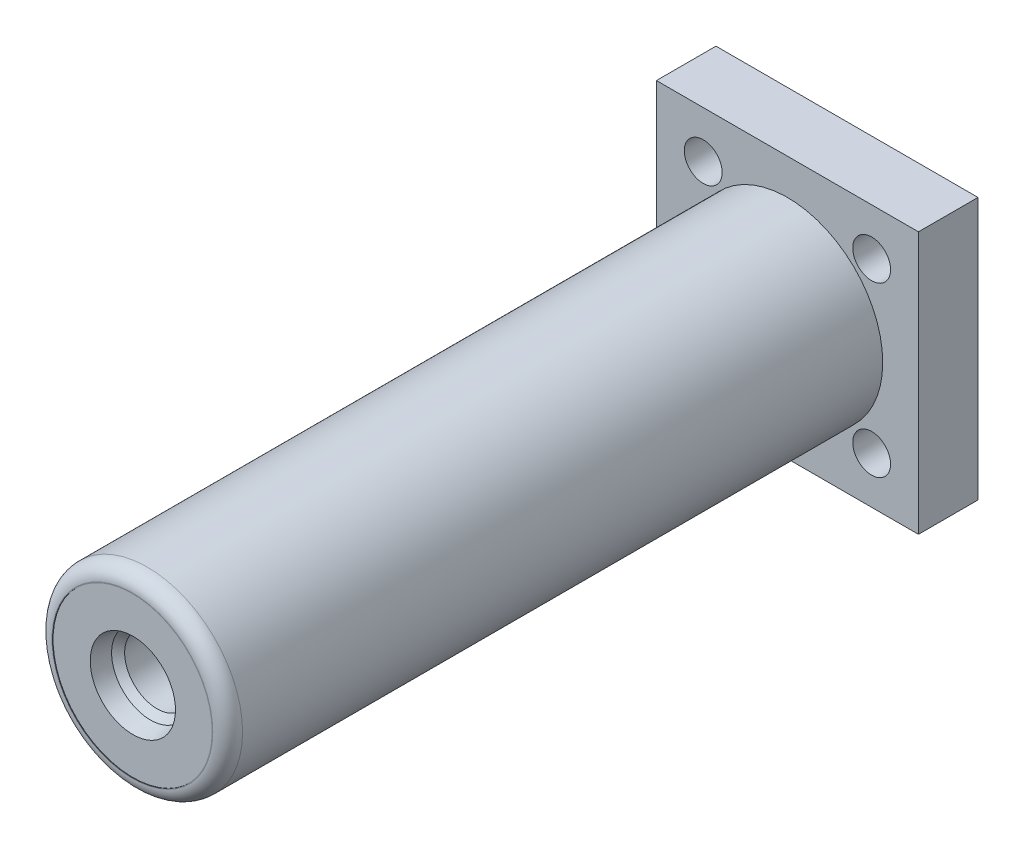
SolidWorks part; units mm, degrees
ref_plane "Front Plane" through (0, 0, 0) normal (0, 0, 1) x (1, 0, 0)
ref_plane "Top Plane" through (0, 0, 0) normal (0, 1, 0) x (1, 0, 0)
ref_plane "Right Plane" through (0, 0, 0) normal (1, 0, 0) x (0, 0, -1)
sketch "Sketch1" plane through (0, 0, 0) normal (0, 0, 1) x (1, 0, 0)
  line L0 (0, 0) -> (0, 13.97) construction
  line L1 (0, 0) -> (13.97, 0) construction
  line L2 (-13.97, 13.97) -> (13.97, 13.97)
  line L3 (13.97, 13.97) -> (13.97, -13.97)
  line L4 (-13.97, 13.97) -> (-13.97, -13.97)
  line L5 (-13.97, -13.97) -> (13.97, -13.97)
  point P9 (-13.97, 0)
  dimension "D1" = 13.97
  dimension "D2" = 13.97
extrude "base" add sketch "Sketch1" along normal blind 6.35
sketch "Sketch2" plane through (0, 0, 6.35) normal (0, 0, 1) x (1, 0, 0)
  circle A0 centre (0, 0) radius 10.16
  dimension "D1" = 20.32
extrude "cylinder" add sketch "Sketch2" along normal blind 69.85
sketch "Sketch3" plane through (0, 0, 0) normal (0, 0, -1) x (-1, 0, 0)
  circle A0 centre (0, 0) radius 5.715
  dimension "D1" = 11.43
extrude "bore" cut sketch "Sketch3" against normal blind 60.96
sketch "Sketch4" plane through (0, 0, 0) normal (0, 0, -1) x (-1, 0, 0)
  circle A0 centre (0, 0) radius 7.1374
  dimension "D1" = 14.2748
extrude "oring_bore" cut sketch "Sketch4" against normal blind 8.128
sketch "Sketch5" plane through (0, 0, 6.35) normal (0, 0, 1) x (1, 0, 0)
  line L0 (0, 0) -> (13.97, 0) construction
  line L1 (13.97, -13.97) -> (13.97, 13.97) construction
  line L2 (0, 0) -> (8.9803, 8.9803) construction
  circle A0 centre (0, 0) radius 12.7 construction
  circle A1 centre (8.9803, 8.9803) radius 2.0193
  circle A2 centre (8.9803, -8.9803) radius 2.0193
  circle A3 centre (-8.9803, -8.9803) radius 2.0193
  circle A4 centre (-8.9803, 8.9803) radius 2.0193
  dimension "D2" = 25.4
  dimension "D3" = 4.0386
  dimension "D1" = 45
extrude "bolt_circle" cut sketch "Sketch5" against normal through all
sketch "Sketch6" plane through (-13.97, 0, 0) normal (-1, 0, 0) x (0, 0, 1)
  circle A0 centre (67.31, 0) radius 2.3813
  dimension "D1" = 4.7625
  dimension "D2" = 67.31
extrude "side_port" cut sketch "Sketch6" against normal blind 16.002
sketch "Sketch7" plane through (-13.97, 0, 0) normal (-1, 0, 0) x (0, 0, 1)
  circle A0 centre (67.31, 0) radius 3.175
  circle A1 centre (67.31, 0) radius 2.3813 construction
  dimension "D1" = 6.35
extrude "side_weld" cut sketch "Sketch7" against normal blind 8.89
sketch "Sketch8" plane through (0, 0, 60.96) normal (0, 0, -1) x (-1, 0, 0)
  circle A0 centre (0, 0) radius 3.175
  dimension "D1" = 6.35
extrude "center_hole" cut sketch "Sketch8" against normal blind 8.89
fillet "Fillet1" radius 1.5875 1 edges at (10.16, 0, 76.2)
sketch "Sketch21" plane through (3.8084, 0.224, 76.2) normal (0, 0, 1) x (1, 0, 0)
  circle A0 centre (-3.8084, -0.224) radius 3.4544
  dimension "D1" = 6.9088
extrude "thru_hole" cut sketch "Sketch21" against normal blind 25.4
sketch "Sketch31" plane through (0, 0, 76.2) normal (0, 0, 1) x (1, 0, 0)
  circle A0 centre (0, 0) radius 8.509
  dimension "D1" = 17.018
extrude "land" cut sketch "Sketch31" against normal blind 0.0508
sketch "Sketch41" plane through (0, 0, 76.1492) normal (0, 0, 1) x (1, 0, 0)
  circle A0 centre (0, 0) radius 4.5466
  dimension "D1" = 9.0932
extrude "12_deg_chamfer" cut sketch "Sketch41" against normal blind 1.8796 draft 12
sketch "Sketch51" plane through (0, 0, 74.2696) normal (0, 0, 1) x (1, 0, 0)
  circle A0 centre (0, 0) radius 4.1529
  dimension "D1" = 8.3058
extrude "45_deg_chamfer" cut sketch "Sketch51" against normal blind 2.54 draft 45
other "boss_7161"
chamfer "Chamfer1" distance 1.016 angle 15 1 edges at (-7.1374, 0, 0)
